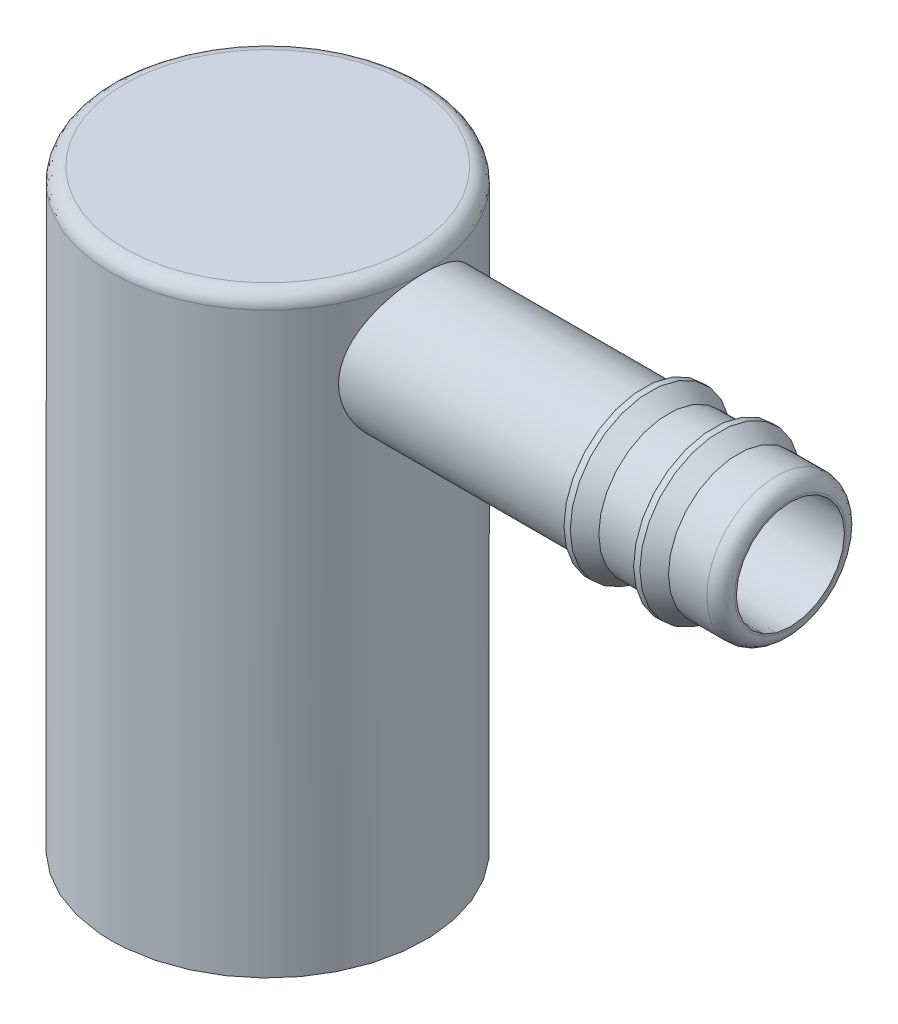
SolidWorks part; units mm, degrees
ref_plane "Front Plane" through (0, 0, 0) normal (0, 0, 1) x (1, 0, 0)
ref_plane "Top Plane" through (0, 0, 0) normal (0, 1, 0) x (1, 0, 0)
ref_plane "Right Plane" through (0, 0, 0) normal (1, 0, 0) x (0, 0, -1)
sketch "Sketch1" plane through (0, 0, 0) normal (0, 1, 0) x (1, 0, 0)
  circle A0 centre (0, 0) radius 14.2875
  dimension "D1" = 28.575
extrude "Extrude1" add sketch "Sketch1" along normal blind 53.975
fillet "Fillet1" radius 1.27 1 edges at (0, 53.975, 14.2875)
sketch "Sketch2" plane through (0, 0, 0) normal (1, 0, 0) x (0, 0, -1)
  line L0 (-14.2875, 52.705) -> (14.2875, 52.705) construction
  circle A0 centre (0, 46.355) radius 6.35
  dimension "D1" = 12.7
extrude "Extrude2" add sketch "Sketch2" along normal blind 47.625
sketch "Sketch3" plane through (0, 0, 0) normal (0, 0, 1) x (1, 0, 0)
  line L0 (34.8627, 53.6575) -> (34.29, 53.6575)
  line L1 (34.29, 53.6575) -> (34.29, 52.705)
  line L2 (34.8627, 53.6575) -> (36.5125, 52.705)
  line L3 (34.29, 52.705) -> (36.5125, 52.705)
  line L4 (47.625, 46.355) -> (19.3756, 46.355) construction
  line L13 (47.625, 52.705) -> (14.2875, 52.705) construction
  line L20 (47.625, 40.005) -> (47.625, 52.705) construction
  line L21 (41.2127, 53.6575) -> (40.64, 53.6575)
  line L22 (40.64, 53.6575) -> (40.64, 52.705)
  line L23 (41.2127, 53.6575) -> (42.8625, 52.705)
  line L24 (40.64, 52.705) -> (42.8625, 52.705)
  dimension "D1" = 0.9525
  dimension "D2" = 13.335
  dimension "D3" = 150
  dimension "D4" = 2.2225
  dimension "D5" = 6.35
revolve "Revolve1" add sketch "Sketch3" angle 360 about L4
sketch "Sketch4" plane through (47.625, 0, 0) normal (1, 0, 0) x (0, 0, -1)
  circle A0 centre (0, 46.355) radius 4.9276
  circle A1 centre (0, 46.355) radius 6.35 construction
  dimension "D1" = 1.4224
sketch "Sketch6" plane through (0, 0, 0) normal (0, 0, 1) x (1, 0, 0)
  line L0 (0, 0) -> (0, 44.6024)
  line L1 (1.7526, 46.355) -> (47.625, 46.355)
  arc A0 (1.7526, 46.355) -> (0, 44.6024) centre (1.7526, 44.6024) ccw
  dimension "D1" = 1.7526
sweep "Cut-Sweep2" cut profiles "Sketch4" path "Sketch6"
fillet "Fillet2" radius 1.27 1 edges at (47.625, 46.355, -6.35)
